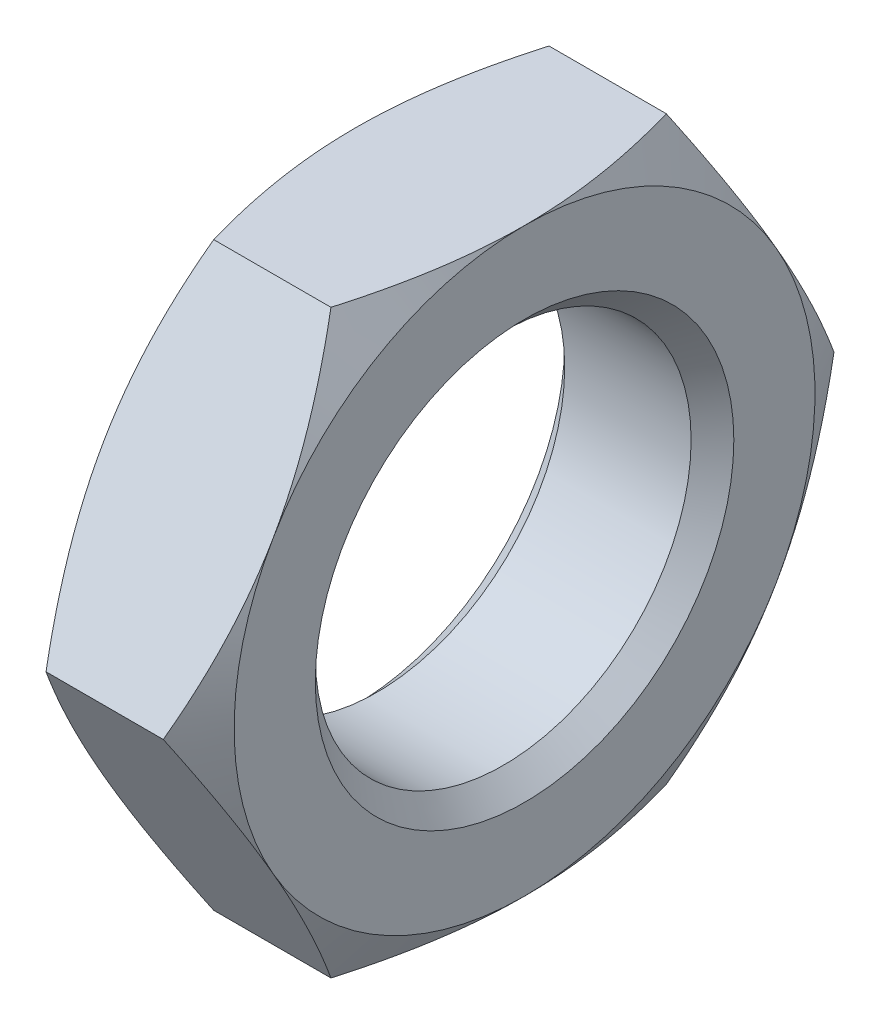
SolidWorks part; units mm, degrees
ref_plane "Front Plane" through (0, 0, 0) normal (0, 0, 1) x (1, 0, 0)
ref_plane "Top Plane" through (0, 0, 0) normal (0, 1, 0) x (1, 0, 0)
ref_plane "Right Plane" through (0, 0, 0) normal (1, 0, 0) x (0, 0, -1)
sketch "Sketch1" plane through (0, 0, 0) normal (1, 0, 0) x (0, 0, -1)
  line L1 (9.815, 17) -> (-9.815, 17)
  line L2 (-9.815, 17) -> (-19.6299, 0)
  line L3 (-19.6299, 0) -> (-9.815, -17)
  line L4 (-9.815, -17) -> (9.815, -17)
  line L5 (9.815, -17) -> (19.6299, 0)
  line L6 (19.6299, 0) -> (9.815, 17)
  circle A0 centre (0, 0) radius 17 construction
  circle A1 centre (0, 0) radius 11
extrude "Extrude1" add sketch "Sketch1" along normal blind 9.9
sketch "Sketch2" plane through (0, 0, 0) normal (0, 0, 1) x (1, 0, 0)
  line L0 (9.9, 17) -> (9.9, 68)
  line L1 (9.9, 68) -> (0, 68)
  line L2 (0, 68) -> (0, 17)
  line L3 (0, 17) -> (4.95, 25.5737)
  line L4 (4.95, 25.5737) -> (9.9, 17)
revolve "Cut-Revolve1" cut sketch "Sketch2" angle 360 about axis through (9.9, 0, 0) along (-1, 0, 0)
chamfer "Chamfer1" distance 1.25 angle 45 2 edges at (0, 0, -11) (9.9, 0, -11)
equation "\"D2@Sketch2\"=\"D1@Sketch1\"*2"
